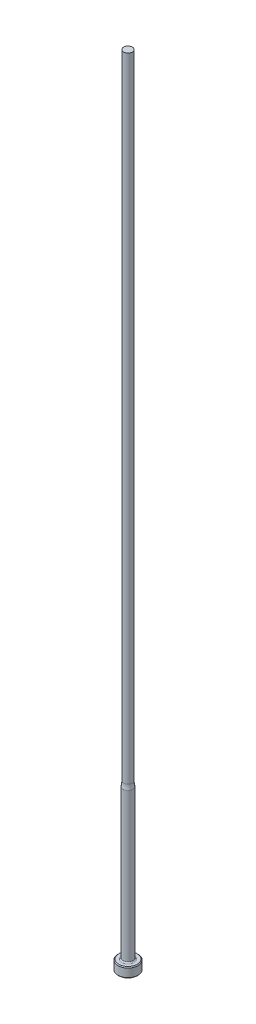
SolidWorks part; units mm, degrees
ref_plane "Front Plane" through (0, 0, 0) normal (0, 0, 1) x (1, 0, 0)
ref_plane "Top Plane" through (0, 0, 0) normal (0, 1, 0) x (1, 0, 0)
ref_plane "Right Plane" through (0, 0, 0) normal (1, 0, 0) x (0, 0, -1)
sketch "Sketch1" plane through (0, 0, 0) normal (0, 0, 1) x (1, 0, 0)
  line L0 (0, 259.9588) -> (0, -15.1925) construction
  line L1 (0, 0) -> (-3.175, 0)
  line L2 (-3.175, 0) -> (-3.175, 3.175)
  line L3 (-3.175, 3.175) -> (-1.5875, 3.175)
  line L4 (-1.3881, 52.3788) -> (-1.3881, 254)
  line L5 (-1.3881, 254) -> (0, 254)
  line L6 (0, 254) -> (0, 0)
  line L7 (-1.5875, 3.175) -> (-1.5875, 50.8)
  arc A0 (-1.5875, 50.8) -> (-1.3881, 52.3788) centre (-7.7381, 52.3788) ccw
  point P13 (-1.5875, 0)
  dimension "D1" = 6.35
  dimension "L" = 254
  dimension "D2" = 3.175
  dimension "H" = 6.35
  dimension "T" = 3.175
  dimension "D" = 2.7762
  dimension "S" = 50.8
revolve "Revolve1" add sketch "Sketch1" angle 360 about L0
chamfer "Chamfer1" distance 0.254 angle 45 2 edges at (0, 3.175, 3.175) (0, 0, 3.175)
fillet "Fillet1" radius 0.381 1 edges at (0, 3.175, 1.5875)
